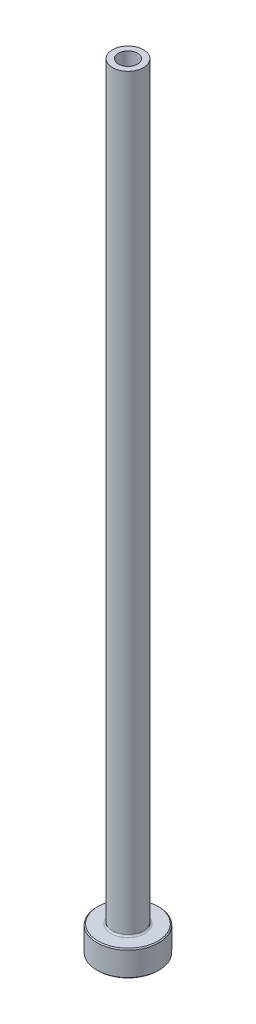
SolidWorks part; units mm, degrees
ref_plane "Front Plane" through (0, 0, 0) normal (0, 0, 1) x (1, 0, 0)
ref_plane "Top Plane" through (0, 0, 0) normal (0, 1, 0) x (1, 0, 0)
ref_plane "Right Plane" through (0, 0, 0) normal (1, 0, 0) x (0, 0, -1)
sketch "Sketch1" plane through (0, 0, 0) normal (0, 0, 1) x (1, 0, 0)
  line L0 (-1.85, 150) -> (-3, 150)
  line L1 (-3, 150) -> (-3, 5)
  line L2 (-3, 5) -> (-6, 5)
  line L3 (-6, 5) -> (-6, 0)
  line L4 (6.6, 0) -> (-6.6, 0) construction
  line L5 (-6, 0) -> (-2.1, 0)
  line L6 (-1.85, 105) -> (-1.85, 150)
  line L7 (0, 92.1877) -> (0, -15.5353) construction
  line L8 (0, -6.6) -> (0, 6.6) construction
  line L9 (-1.85, 105) -> (-2.1, 93)
  line L10 (-2.1, 93) -> (-2.1, 0)
  dimension "D1" = 0.25
  dimension "ID" = 3.7
  dimension "OD" = 6
  dimension "L" = 150
  dimension "H" = 12
  dimension "T" = 5
  dimension "N" = 45
  dimension "D2" = 12
revolve "Revolve1" add sketch "Sketch1" angle 360 about L7
fillet "Fillet1" radius 0.3 1 edges at (0, 5, 3)
chamfer "Chamfer1" distance 0.2 angle 45 2 edges at (0, 5, 6) (0, 0, 6)
chamfer "Chamfer3" distance 0.5 angle 45 1 edges at (0, 0, 2.1)
